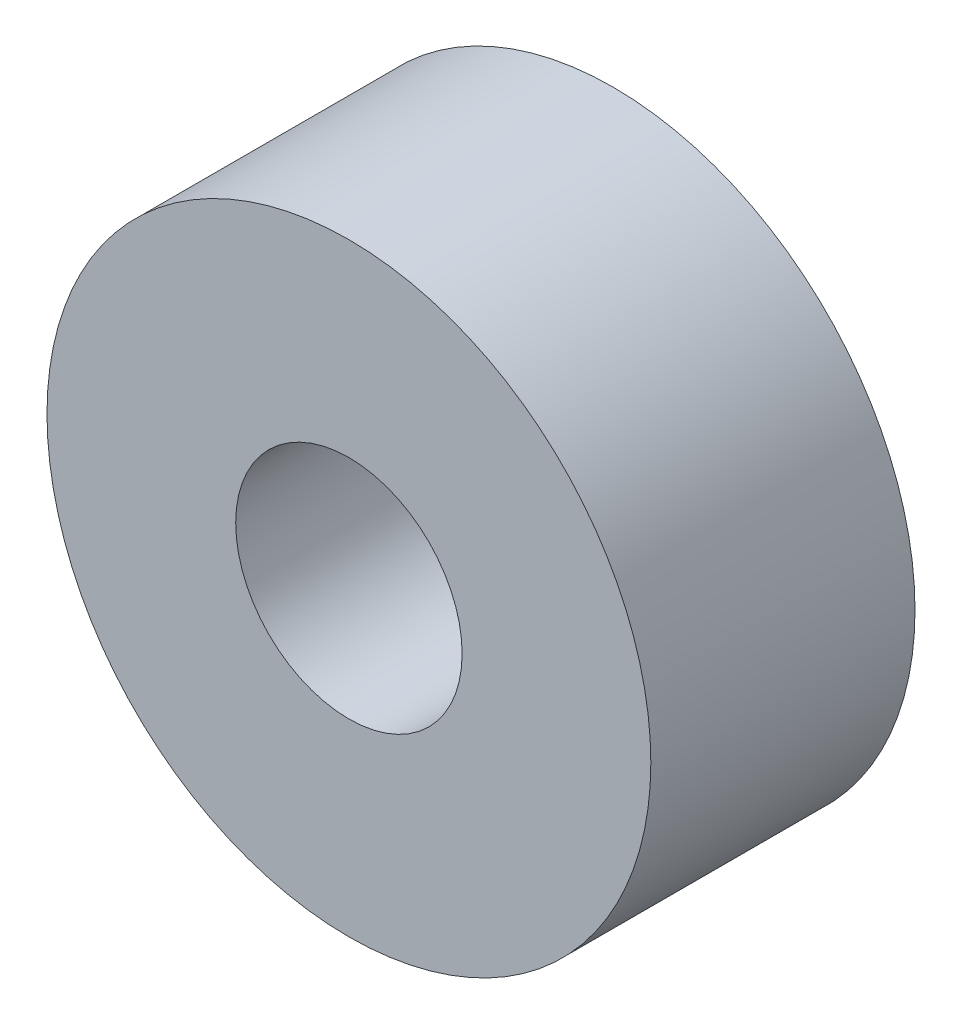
SolidWorks part; units mm, degrees
ref_plane "XY" through (0, 0, 0) normal (0, 0, 1) x (1, 0, 0)
ref_plane "XZ" through (0, 0, 0) normal (0, 1, 0) x (1, 0, 0)
ref_plane "YZ" through (0, 0, 0) normal (1, 0, 0) x (0, 0, -1)
sketch "Esquisse1" plane through (0, 0, 0) normal (0, 0, 1) x (1, 0, 0)
  circle A0 centre (0, 0) radius 4 construction
  circle A1 centre (0, 0) radius 4
  circle A2 centre (0, 0) radius 1.5
  dimension "D1" = 2.5
extrude "Boss.-Extru.1" add sketch "Esquisse1" against normal up to surface (3.5 mm away)
